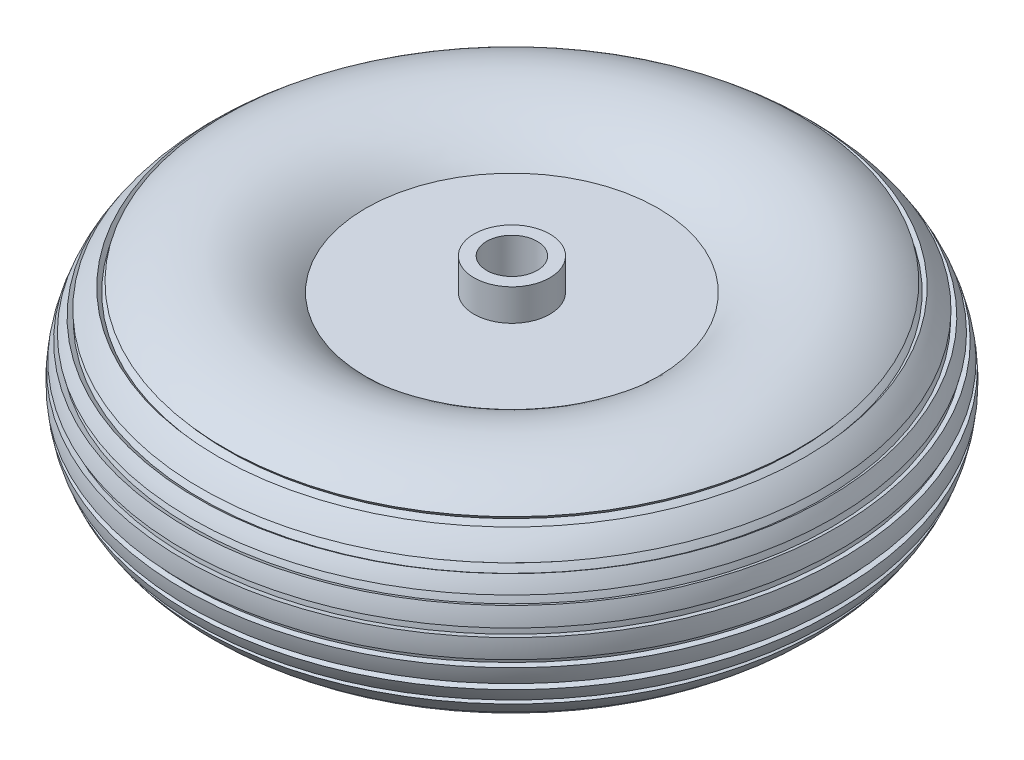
SolidWorks part; units mm, degrees
ref_plane "Front Plane" through (0, 0, 0) normal (1, 0, 0) x (0, 1, 0)
ref_plane "Top Plane" through (0, 0, 0) normal (0, 0, 1) x (0, 1, 0)
ref_plane "Right Plane" through (0, 0, 0) normal (0, 1, 0) x (-1, 0, 0)
sketch "Sketch2" plane through (0, 0, 0) normal (1, 0, 0) x (0, 1, 0)
  line L0 (0, 22.676) -> (0, 65.0707)
  line L1 (-6.4642, 62.5628) -> (-6.799, 64.6287)
  line L2 (-30, -7.428) -> (-30, -51.7948)
  line L3 (30, -51.7948) -> (30, -7.428)
  line L4 (-21.6439, 59.2519) -> (-20.4806, 57.5083)
  line L5 (-13.3922, 63.0108) -> (-12.5922, 61.0711)
  line L6 (-30.1684, 49.5574) -> (-31.7309, 50.9497)
  line L7 (-33.6464, 48.6408) -> (-32.0347, 47.3037)
  line L8 (-22.98, 55.9125) -> (-24.1702, 57.6339)
  line L9 (-15.4063, 60.0309) -> (-16.2043, 61.9656)
  line L10 (-3.799, 65.0059) -> (-3.468, 62.9341)
  line L11 (3.799, 65.0059) -> (3.468, 62.9341)
  line L12 (6.4642, 62.5628) -> (6.799, 64.6287)
  line L13 (15.4063, 60.0309) -> (16.2043, 61.9656)
  line L14 (13.3922, 63.0108) -> (12.5922, 61.0711)
  line L15 (22.98, 55.9125) -> (24.1702, 57.6339)
  line L16 (21.6439, 59.2519) -> (20.4806, 57.5083)
  line L17 (30.1684, 49.5574) -> (31.7309, 50.9497)
  line L18 (33.6464, 48.6408) -> (32.0347, 47.3037)
  line L19 (30, -20.176) -> (30, -65.176)
  line L20 (-30, -55.176) -> (-30, -65.176)
  line L21 (-30, -65.176) -> (30, -65.176)
  line L22 (30, -65.176) -> (-30, -65.176)
  line L23 (-30, -65.176) -> (-30, -55.176)
  line L24 (-30, -51.7948) -> (-30, -55.176) construction
  line L25 (-30, -51.7948) -> (-30, -65.176)
  line L26 (30, -65.176) -> (30, -51.7948)
  line L27 (-30, -51.7948) -> (-30, -65.176)
  line L28 (-30, -65.176) -> (30, -65.176)
  line L29 (30, -51.7948) -> (30, -65.176)
  line L30 (-30, -55.176) -> (30, -55.176)
  arc A0 (30, -7.428) -> (33.6464, 48.6408) centre (0, 22.676) ccw
  arc A1 (-32.0347, 47.3037) -> (-30.1684, 49.5574) centre (0, 22.676) cw
  arc A2 (-22.98, 55.9125) -> (-20.4806, 57.5083) centre (0, 22.676) cw
  arc A3 (-15.4063, 60.0309) -> (-12.5922, 61.0711) centre (0, 22.676) cw
  arc A4 (-6.4642, 62.5628) -> (-3.468, 62.9341) centre (0, 22.676) cw
  arc A5 (6.4642, 62.5628) -> (3.468, 62.9341) centre (0, 22.676) ccw
  arc A6 (15.4063, 60.0309) -> (12.5922, 61.0711) centre (0, 22.676) ccw
  arc A7 (22.98, 55.9125) -> (20.4806, 57.5083) centre (0, 22.676) ccw
  arc A8 (32.0347, 47.3037) -> (30.1684, 49.5574) centre (0, 22.676) ccw
  arc A9 (-33.6464, 48.6408) -> (-30, -7.428) centre (0, 22.676) ccw
  arc A10 (-24.1702, 57.6339) -> (-31.7309, 50.9497) centre (0, 22.676) ccw
  arc A11 (-16.2043, 61.9656) -> (-21.6439, 59.2519) centre (0, 22.676) ccw
  arc A12 (-6.799, 64.6287) -> (-13.3922, 63.0108) centre (0, 22.676) ccw
  arc A13 (3.799, 65.0059) -> (-3.799, 65.0059) centre (0, 22.676) ccw
  arc A14 (13.3922, 63.0108) -> (6.799, 64.6287) centre (0, 22.676) ccw
  arc A15 (21.6439, 59.2519) -> (16.2043, 61.9656) centre (0, 22.676) ccw
  arc A16 (31.7309, 50.9497) -> (24.1702, 57.6339) centre (0, 22.676) ccw
  point P6 (0, 22.676)
  point P8 (-7.8266, 48.5355)
  dimension "D1" = 85
  dimension "D2" = 3
  dimension "D3" = 3
  dimension "D4" = 44.3669
  dimension "D5" = 45
  dimension "D6" = 10
revolve "Revolve1" add sketch "Sketch2" angle 360 about L21
sketch "Sketch3" plane through (0, -30, 0) normal (0, -1, 0) x (1, 0, 0)
  circle A0 centre (0, -65.176) radius 10
  circle A1 centre (0, -65.176) radius 15
  dimension "D1" = 30
extrude "Boss-Extrude1" add sketch "Sketch3" along normal blind 12.5
sketch "Sketch4" plane through (0, 30, 0) normal (0, 1, 0) x (-1, 0, 0)
  circle A0 centre (0, -65.176) radius 15
  circle A1 centre (0, -65.176) radius 10
  dimension "D1" = 30
extrude "Boss-Extrude2" add sketch "Sketch4" along normal blind 12.5
